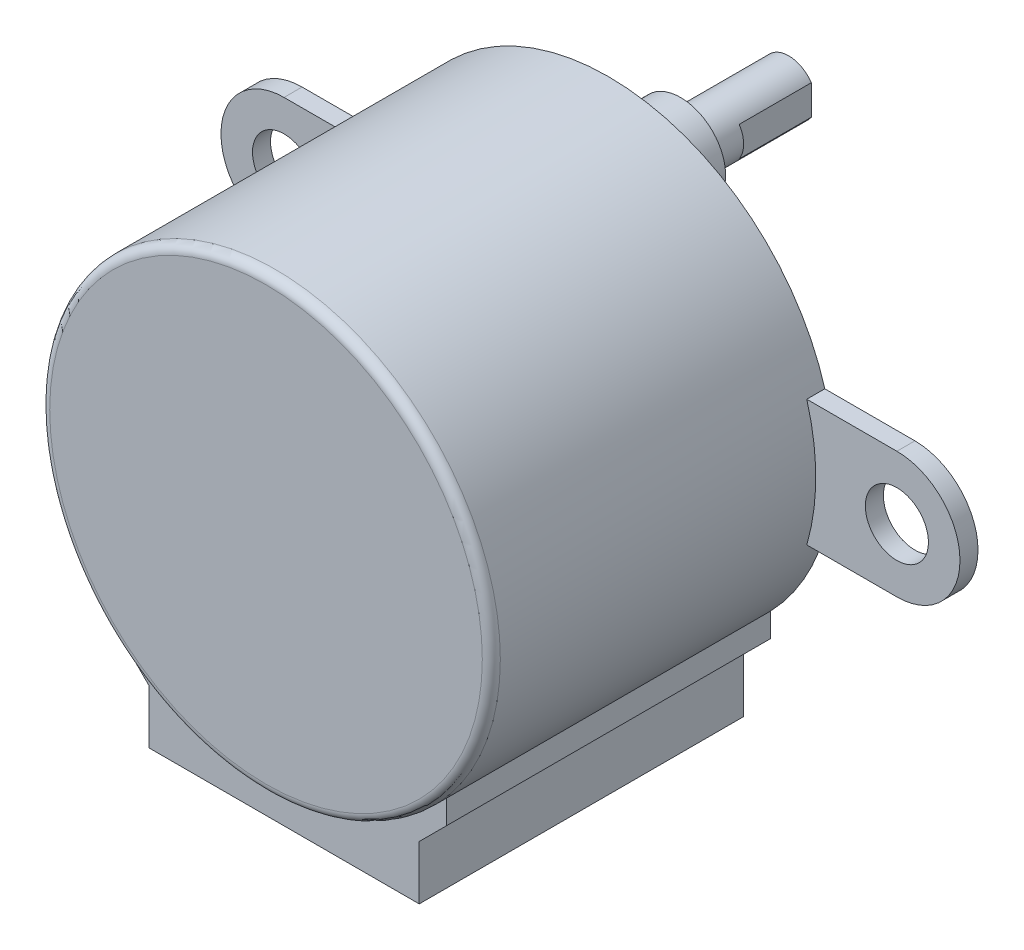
SolidWorks part; units mm, degrees
ref_plane "Plan de face" through (0, 0, 0) normal (0, 0, 1) x (1, 0, 0)
ref_plane "Plan de dessus" through (0, 0, 0) normal (0, 1, 0) x (1, 0, 0)
ref_plane "Plan de droite" through (0, 0, 0) normal (1, 0, 0) x (0, 0, -1)
sketch "Esquisse1" plane through (0, 0, 0) normal (0, 0, 1) x (1, 0, 0)
  circle A0 centre (0, 0) radius 12.5
  dimension "D1" = 25
extrude "Extrusion1" add sketch "Esquisse1" along normal blind 19
sketch "Esquisse2" plane through (0, 0, 0) normal (0, 0, -1) x (-1, 0, 0)
  line L0 (0, 0) -> (0, -14.5605) construction
  line L1 (-9, -8.6747) -> (-9, -10)
  line L2 (-9, -10) -> (-7.5, -11.5)
  line L3 (-7.5, -11.5) -> (-7.5, -14.5)
  line L4 (7.5, -11.5) -> (7.5, -14.5)
  line L5 (9, -10) -> (7.5, -11.5)
  line L6 (9, -8.6747) -> (9, -10)
  line L7 (-7.5, -14.5) -> (7.5, -14.5)
  circle A1 centre (0, 0) radius 12.5
  arc A2 (-9, -8.6747) -> (9, -8.6747) centre (0, 0) ccw
  dimension "D2" = 27
  dimension "D3" = 15
  dimension "D4" = 18
  dimension "D5" = 3
  dimension "D6" = 135
  dimension "D1" = 0
extrude "Extrusion2" add sketch "Esquisse2" against normal offset from surface (18 mm away) 1
fillet "Congé1" radius 0.5 1 edges at (12.5, 0, 19)
sketch "Esquisse3" plane through (0, 0, 0) normal (0, 0, -1) x (-1, 0, 0)
  line L0 (17, 3.5) -> (12, 3.5)
  line L1 (17, -3.5) -> (12, -3.5)
  arc A0 (9, -8.6747) -> (-9, -8.6747) centre (0, 0) ccw construction
  arc A1 (12, -3.5) -> (12, 3.5) centre (0, 0) ccw
  arc A2 (17, -3.5) -> (17, 3.5) centre (17, 0) ccw
  circle A3 centre (17, 0) radius 1.75
  dimension "D1" = 3.5
  dimension "D3" = 3.5
  dimension "e/2" = 17
extrude "Extrusion3" add sketch "Esquisse3" against normal blind 1
mirror "Symétrie1" about plane through (0, 0, 0) normal (1, 0, 0) of "Extrusion3"
sketch "Esquisse4" plane through (0, 0, 0) normal (0, 0, -1) x (-1, 0, 0)
  circle A0 centre (0, 7) radius 3
  dimension "a" = 6
  dimension "d" = 7
extrude "Extrusion4" add sketch "Esquisse4" along normal blind 1
sketch "Esquisse5" plane through (0, 0, -1) normal (0, 0, -1) x (-1, 0, 0)
  circle A0 centre (0, 7) radius 2.5
  dimension "D1" = 5
extrude "Extrusion5" add sketch "Esquisse5" along normal blind 3
sketch "Esquisse6" plane through (0, 0, -4) normal (0, 0, -1) x (-1, 0, 0)
  circle A0 centre (0, 7) radius 1.5
  dimension "D1" = 3
extrude "Extrusion6" add sketch "Esquisse6" along normal blind 6
sketch "Esquisse7" plane through (0, 0, -10) normal (0, 0, -1) x (-1, 0, 0)
  line L0 (0, 7) -> (0, 11.4068) construction
  line L1 (-1.25, 7.8292) -> (-1.25, 6.1708)
  line L2 (1.25, 7.8292) -> (1.25, 6.1708)
  circle A0 centre (0, 7) radius 1.5 construction
  arc A1 (-1.25, 7.8292) -> (-1.25, 6.1708) centre (0, 7) ccw
  arc A2 (1.25, 6.1708) -> (1.25, 7.8292) centre (0, 7) ccw
  dimension "D1" = 2.5
extrude "Enlèv. mat.-Extru.1" cut sketch "Esquisse7" against normal blind 4
